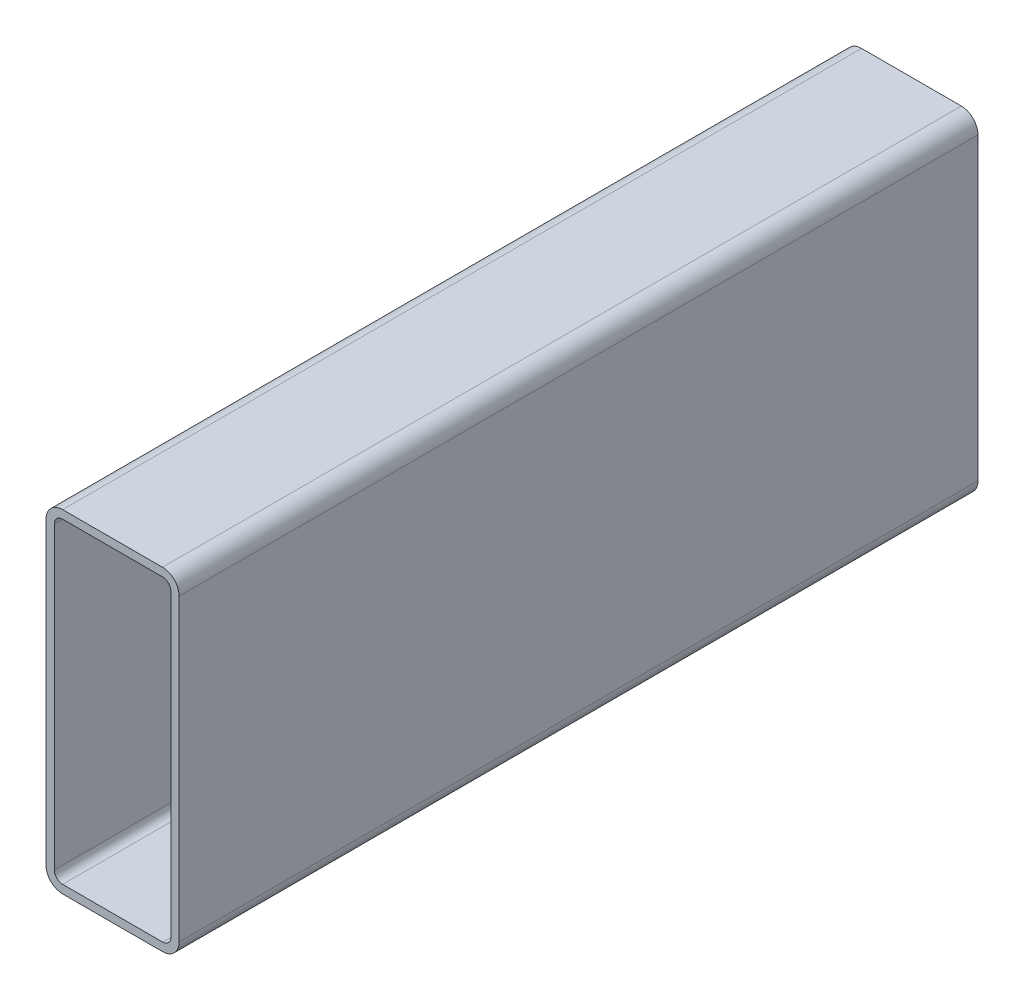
SolidWorks part; units mm, degrees
ref_plane "Front Plane" through (0, 0, 0) normal (0, 0, 1) x (1, 0, 0)
ref_plane "Top Plane" through (0, 0, 0) normal (0, 1, 0) x (1, 0, 0)
ref_plane "Right Plane" through (0, 0, 0) normal (1, 0, 0) x (0, 0, -1)
sketch "Sketch1" plane through (0, 0, 0) normal (0, 0, 1) x (1, 0, 0)
  line B0 (6.35, 127) -> (44.45, 127)
  arc B1 (50.8, 120.65) -> (44.45, 127) centre (44.45, 120.65) ccw
  line B2 (50.8, 120.65) -> (50.8, 6.35)
  arc B3 (44.45, 0) -> (50.8, 6.35) centre (44.45, 6.35) ccw
  line B4 (44.45, 0) -> (6.35, 0)
  arc B5 (0, 6.35) -> (6.35, 0) centre (6.35, 6.35) ccw
  line B6 (0, 6.35) -> (0, 120.65)
  arc B7 (6.35, 127) -> (0, 120.65) centre (6.35, 120.65) ccw
  line B8 (6.35, 123.825) -> (44.45, 123.825)
  arc B9 (47.625, 120.65) -> (44.45, 123.825) centre (44.45, 120.65) ccw
  line B10 (47.625, 120.65) -> (47.625, 6.35)
  arc B11 (44.45, 3.175) -> (47.625, 6.35) centre (44.45, 6.35) ccw
  line B12 (44.45, 3.175) -> (6.35, 3.175)
  arc B13 (3.175, 6.35) -> (6.35, 3.175) centre (6.35, 6.35) ccw
  line B14 (3.175, 6.35) -> (3.175, 120.65)
  arc B15 (6.35, 123.825) -> (3.175, 120.65) centre (6.35, 120.65) ccw
sketch_block_instance "HSS5x2x0.125-1"
sketch_block "HSS5x2x0.125"
extrude "Boss-Extrude1" add sketch "Sketch1" along normal blind 304.8
